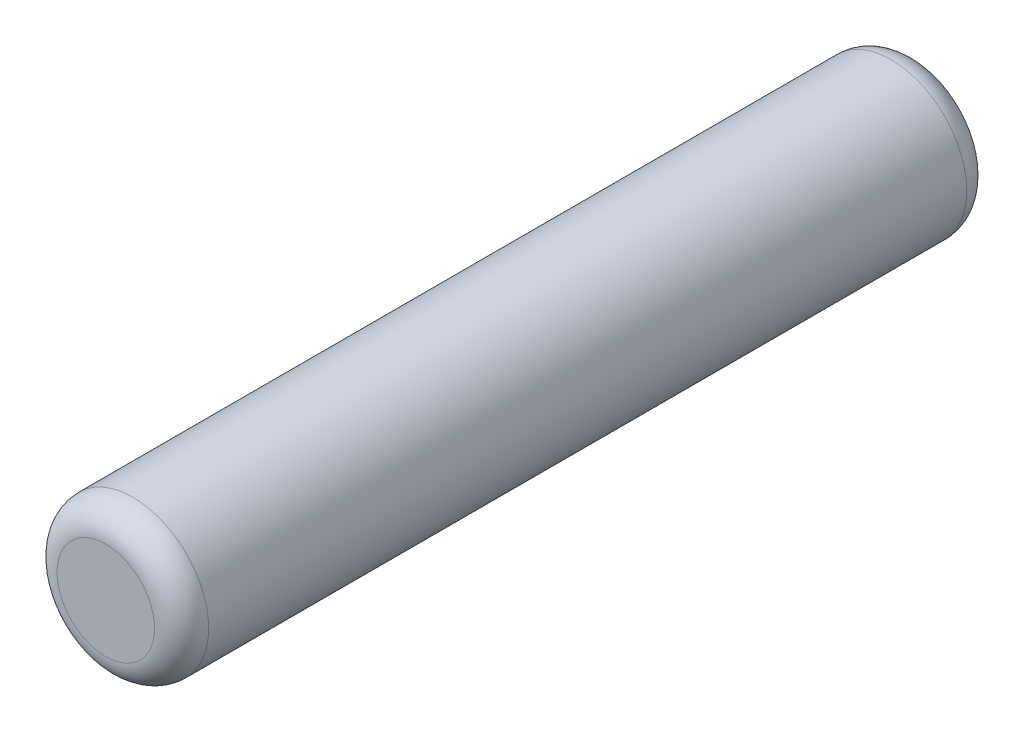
SolidWorks part; units mm, degrees
ref_plane "Front" through (0, 0, 0) normal (0, 0, 1) x (1, 0, 0)
ref_plane "Top" through (0, 0, 0) normal (0, 1, 0) x (1, 0, 0)
ref_plane "Right" through (0, 0, 0) normal (1, 0, 0) x (0, 0, -1)
sketch "草图1" plane through (0, 0, 0) normal (0, 0, 1) x (1, 0, 0)
  circle A0 centre (0, 0) radius 1.4
  dimension "D1" = 2.8
extrude "凸台-拉伸1" add sketch "草图1" along normal blind 15
fillet "圆角1" radius 0.5 2 edges at (1.4, 0, 0) (1.4, 0, 15)
